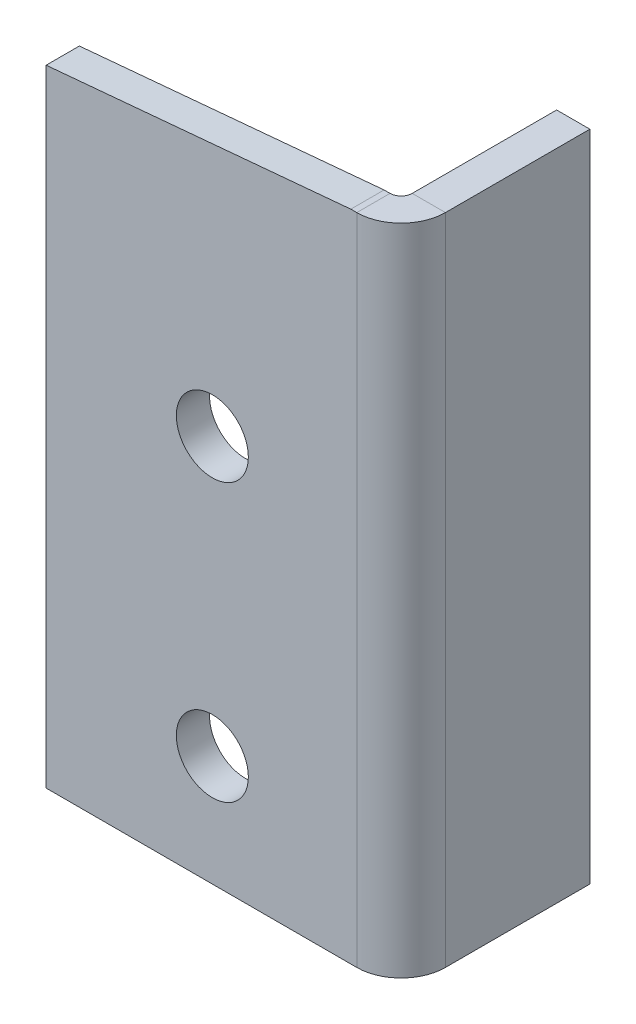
SolidWorks part; units mm, degrees
ref_plane "前视基准面" through (0, 0, 0) normal (0, 0, 1) x (1, 0, 0)
ref_plane "上视基准面" through (0, 0, 0) normal (0, 1, 0) x (1, 0, 0)
ref_plane "右视基准面" through (0, 0, 0) normal (1, 0, 0) x (0, 0, -1)
sketch "草图1" plane through (0, 0, 0) normal (0, 0, 1) x (1, 0, 0)
  line L0 (-35, 118) -> (0, 118)
  line L1 (-90, 0) -> (0, 0)
  line L2 (-90, 0) -> (-90, 113)
  line L3 (-90, 113) -> (-35, 118)
  line L4 (0, 0) -> (0, 118)
  circle A0 centre (-60, 20) radius 6.5
  circle A1 centre (-60, 70) radius 6.5
  dimension "D4" = 13
  dimension "D6" = 30
  dimension "D7" = 30
  dimension "D8" = 50
  dimension "D1" = 90
  dimension "D2" = 118
  dimension "D3" = 113
  dimension "D5" = 20
  dimension "D9" = 35
sheet metal parameters "钣金1" thickness 6 parameters "D1"=2
base flange "基体-法兰1" sketch "草图1" thickness 6 reverse thickness direction yes parameters "D1"=2
sketch "草图2" plane through (0, 0, 0) normal (0, 0, -1) x (-1, 0, 0)
  line L2 (30, 0) -> (30, 118)
  line L3 (30, 0) -> (30, 118)
  dimension "D1" = 30
sketched bend "绘制的折弯1" parameters "D1"=2
bend "草图折弯1" bend radius 2 bend angle 90 parameters "D5"=1
flat pattern "平板型式1"
sketch "折弯-线1" plane through (0, 0, 0) normal (0, 1, 0) x (-1, 0, 0)
bend of the flat pattern "展开-<草图折弯1>1"
